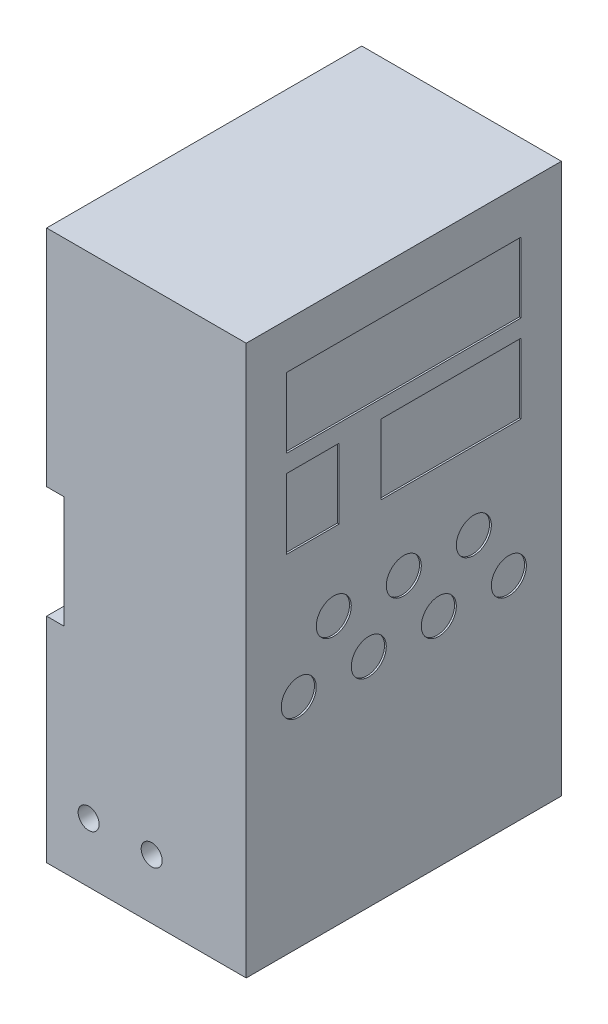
SolidWorks part; units mm, degrees
ref_plane "前视基准面" through (0, 0, 0) normal (0, 0, 1) x (1, 0, 0)
ref_plane "上视基准面" through (0, 0, 0) normal (0, 1, 0) x (1, 0, 0)
ref_plane "右视基准面" through (0, 0, 0) normal (1, 0, 0) x (0, 0, -1)
sketch "草图1" plane through (0, 0, 0) normal (0, 0, 1) x (1, 0, 0)
  line L0 (0, 0) -> (57, 0)
  line L1 (57, 0) -> (57, 157)
  line L2 (57, 157) -> (0, 157)
  line L3 (0, 157) -> (0, 93)
  line L4 (0, 0) -> (0, 61)
  line L5 (0, 61) -> (5, 61)
  line L6 (0, 93) -> (5, 93)
  line L7 (5, 93) -> (5, 61)
extrude "凸台-拉伸1" add sketch "草图1" along normal blind 90 contours L6 L7 L5 L4 L0 L1 L2 L3
sketch "草图2" plane through (0, 0, 90) normal (0, 0, 1) x (1, 0, 0)
  line L0 (0, 0) -> (57, 0) construction
  line L1 (0, 0) -> (0, 61) construction
  circle A0 centre (12, 17) radius 3
  circle A1 centre (30, 17) radius 3
  dimension "D1" = 17
  dimension "D2" = 17
  dimension "D3" = 12
  dimension "D4" = 18
extrude "切除-拉伸1" cut sketch "草图2" against normal blind 70
sketch "草图3" plane through (57, 0, 0) normal (1, 0, 0) x (0, 0, -1)
  line L0 (-45, 157) -> (-45, 134) construction
  line L1 (-90, 157) -> (0, 157) construction
  line L3 (-11.5, 144) -> (-78.5, 144)
  line L4 (-11.5, 144) -> (-11.5, 124)
  line L5 (-11.5, 124) -> (-78.5, 124)
  line L6 (-78.5, 144) -> (-78.5, 124)
  line L7 (-11.5, 144) -> (-78.5, 124) construction
  line L8 (-11.5, 124) -> (-78.5, 144) construction
  dimension "D1" = 67
  dimension "D2" = 20
extrude "切除-拉伸2" cut sketch "草图3" against normal blind 0.5
sketch "草图4" plane through (57, 0, 0) normal (1, 0, 0) x (0, 0, -1)
  line L0 (-78.5, 124) -> (-78.5, 119) construction
  line L1 (-11.5, 124) -> (-11.5, 119) construction
  line L2 (-45, 157) -> (-45, 77) construction
  line L3 (-78.5, 119) -> (-63.5, 119)
  line L4 (-78.5, 119) -> (-78.5, 99)
  line L5 (-78.5, 99) -> (-63.5, 99)
  line L6 (-63.5, 119) -> (-63.5, 99)
  line L7 (-11.5, 119) -> (-51.5, 119)
  line L8 (-11.5, 119) -> (-11.5, 99)
  line L9 (-11.5, 99) -> (-51.5, 99)
  line L10 (-51.5, 119) -> (-51.5, 99)
  line L11 (-90, 157) -> (0, 157) construction
  line L12 (-45, 77) -> (-25, 77) construction
  line L13 (-45, 77) -> (-45, 62) construction
  line L14 (-45, 62) -> (-35, 62) construction
  line L15 (-35, 62) -> (-15, 62) construction
  circle A0 centre (-45, 77) radius 5
  circle A1 centre (-25, 77) radius 5
  circle A2 centre (-65, 77) radius 5
  circle A3 centre (-35, 62) radius 5
  circle A4 centre (-15, 62) radius 5
  circle A5 centre (-55, 62) radius 5
  circle A6 centre (-75, 62) radius 5
  dimension "D1" = 15
  dimension "D2" = 20
  dimension "D3" = 40
  dimension "D4" = 20
extrude "切除-拉伸3" cut sketch "草图4" against normal blind 0.5
